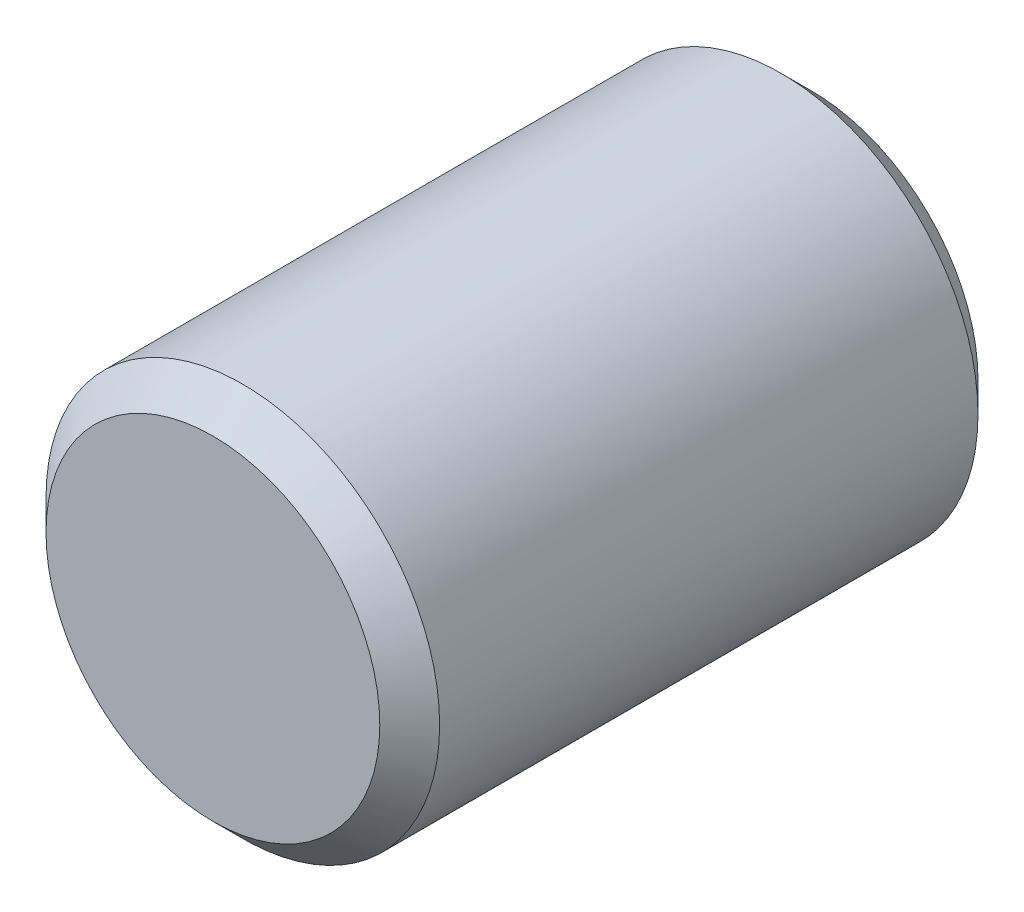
SolidWorks part; units mm, degrees
ref_plane "Plan de face" through (0, 0, 0) normal (0, 0, 1) x (1, 0, 0)
ref_plane "Plan de dessus" through (0, 0, 0) normal (0, 1, 0) x (1, 0, 0)
ref_plane "Plan de droite" through (0, 0, 0) normal (1, 0, 0) x (0, 0, -1)
sketch "Esquisse1" plane through (0, 0, 0) normal (0, 0, 1) x (1, 0, 0)
  circle A0 centre (0, 0) radius 6.58
  dimension "D1" = 13.16
extrude "Extrusion1" add sketch "Esquisse1" along normal blind 20
chamfer "Chanfrein1" distance 1 angle 45 2 edges at (6.58, 0, 0) (6.58, 0, 20)
